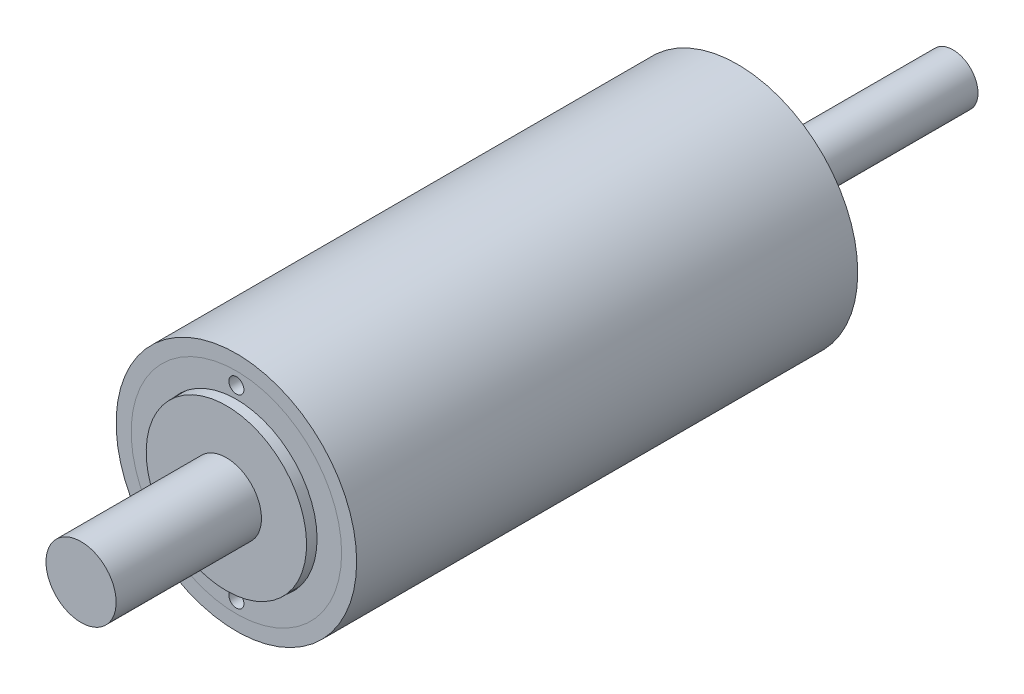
SolidWorks part; units mm, degrees
other "Spacer"
other "6201 DgFr"
other "Front Preload Nut"
other "7203 AngRr"
other "7203 AngFr"
other "Inner Spindle"
other "Lockring Rear"
other "Lockring Front"
other "Outer Spindle"
other "Rear Preload"
other "6201 DgRr"
ref_plane "Front Plane" through (0, 0, 0) normal (0, 0, 1) x (1, 0, 0)
ref_plane "Top Plane" through (0, 0, 0) normal (0, 1, 0) x (1, 0, 0)
ref_plane "Right Plane" through (0, 0, 0) normal (1, 0, 0) x (0, 0, -1)
sketch "Sketch1" plane through (0, 0, 0) normal (1, 0, 0) x (0, 0, -1)
  line L0 (-126.3943, 0) -> (126.3943, 0) construction
  line L1 (-50, 19.3253) -> (-50, -19.3253) construction
  line L2 (50, 19.03) -> (50, -19.03) construction
  line L3 (-81, 0) -> (-81, 7)
  line L4 (-81, 7) -> (-52, 7)
  line L5 (-52, 7) -> (-52, 16)
  line L6 (-52, 16) -> (-48, 16)
  line L7 (-48, 16) -> (-48, 7.4)
  line L8 (-48, 7.4) -> (-44, 7.4)
  line L9 (-44, 7.4) -> (-44, 11)
  line L10 (-44, 11) -> (-40, 11)
  line L11 (-40, 11) -> (-40, 8.5)
  line L12 (-40, 8.5) -> (-16, 8.5)
  line L15 (-1, 8.45) -> (-1, 7.4)
  line L17 (-1, 7.4) -> (9, 7.4)
  line L18 (9, 7.4) -> (9, 6)
  line L21 (53, 5.95) -> (53, 5)
  line L22 (53, 5) -> (93, 5)
  line L23 (93, 5) -> (93, 0)
  line L24 (-81, 0) -> (93, 0)
  line L26 (-16, 7.5) -> (-14, 7.5)
  line L27 (-14, 7.5) -> (-14, 8.45)
  line L28 (-14, 8.45) -> (-1, 8.45)
  line L29 (9, 6) -> (39, 6)
  line L30 (39, 6) -> (39, 5)
  line L31 (39, 5) -> (41, 5)
  line L32 (41, 5) -> (41, 5.95)
  line L33 (41, 5.95) -> (53, 5.95)
  line L34 (-16, 8.5) -> (-16, 7.5)
  point P4 (0, 0)
  point P7 (-50, 0)
  point P10 (50, 0)
  point P22 (0, 0)
  point P36 (0, 0)
  point P38 (-16, 8)
  dimension "D1" = 50
  dimension "D2" = 50
  dimension "D3" = 7
  dimension "D4" = 29
  dimension "D5" = 16
  dimension "D6" = 4
  dimension "D7" = 7.4
  dimension "D8" = 2
  dimension "D9" = 6
  dimension "D10" = 11
  dimension "D11" = 4
  dimension "D12" = 8.5
  dimension "D13" = 24
  dimension "D14" = 8.45
  dimension "D15" = 2
  dimension "D16" = 15
  dimension "D17" = 41
  dimension "D18" = 6
  dimension "D19" = 7.5
  dimension "D20" = 30
  dimension "D21" = 7.4
  dimension "D22" = 3
  dimension "D23" = 5
  dimension "D24" = 40
  dimension "D25" = 5.95
  dimension "D26" = 2
  dimension "D27" = 5
revolve "Revolve2" add sketch "Sketch1" angle 360 about L0
sketch "Sketch5" plane through (0, 0, 40) normal (0, 0, -1) x (-1, 0, 0)
  circle A0 centre (0, 0) radius 8.5 construction
  circle A1 centre (0, 0) radius 8.5
  circle A2 centre (0, 0) radius 20
  dimension "D1" = 40
extrude "Boss-Extrude1" add sketch "Sketch5" along normal blind 12 separate body
sketch "Sketch6" plane through (0, 0, 28) normal (0, 0, -1) x (-1, 0, 0)
  circle A0 centre (0, 0) radius 8.5 construction
  circle A1 centre (0, 0) radius 8.5
  circle A2 centre (0, 0) radius 20
  dimension "D1" = 40
extrude "Boss-Extrude2" add sketch "Sketch6" along normal blind 12 separate body
sketch "Sketch7" plane through (0, 0, 16) normal (0, 0, -1) x (-1, 0, 0)
  circle A0 centre (0, 0) radius 8.5 construction
  circle A1 centre (0, 0) radius 8.5
  circle A2 centre (0, 0) radius 11.5
  dimension "D1" = 23
extrude "Boss-Extrude3" add sketch "Sketch7" along normal blind 2 separate body
sketch "Sketch8" plane through (0, 0, 14) normal (0, 0, -1) x (-1, 0, 0)
  circle A0 centre (0, 0) radius 17.5
  circle A1 centre (0, 0) radius 8.5 construction
  circle A2 centre (0, 0) radius 8.5
  dimension "D1" = 35
extrude "Boss-Extrude4" add sketch "Sketch8" along normal blind 8
sketch "Sketch9" plane through (0, 0, -9) normal (0, 0, -1) x (-1, 0, 0)
  circle A0 centre (0, 0) radius 6 construction
  circle A1 centre (0, 0) radius 6
  circle A2 centre (0, 0) radius 16
  dimension "D1" = 32
extrude "Boss-Extrude5" add sketch "Sketch9" along normal blind 10 separate body
sketch "Sketch11" plane through (0, 0, -19) normal (0, 0, -1) x (-1, 0, 0)
  circle A0 centre (0, 0) radius 16 construction
  circle A1 centre (0, 0) radius 16
  circle A2 centre (0, 0) radius 14
  circle A3 centre (0, 0) radius 15.5
  dimension "D1" = 28
  dimension "D2" = 31
extrude "Boss-Extrude8" add sketch "Sketch11" along normal blind 10 separate body contours A3 A2
sketch "Sketch12" plane through (0, 0, -29) normal (0, 0, -1) x (-1, 0, 0)
  circle A0 centre (0, 0) radius 6 construction
  circle A1 centre (0, 0) radius 6
  circle A2 centre (0, 0) radius 16
  dimension "D1" = 32
extrude "Boss-Extrude9" add sketch "Sketch12" along normal blind 10 separate body
sketch "Sketch13" plane through (0, 0, -39) normal (0, 0, -1) x (-1, 0, 0)
  circle A0 centre (0, 0) radius 6 construction
  circle A1 centre (0, 0) radius 6
  circle A2 centre (0, 0) radius 9
  dimension "D1" = 18
extrude "Boss-Extrude10" add sketch "Sketch13" along normal blind 2 separate body
sketch "Sketch14" plane through (0, 0, -41) normal (0, 0, -1) x (-1, 0, 0)
  circle A0 centre (0, 0) radius 13
  circle A1 centre (0, 0) radius 6 construction
  circle A2 centre (0, 0) radius 6
  dimension "D1" = 26
extrude "Boss-Extrude11" add sketch "Sketch14" along normal blind 8
sketch "Sketch15" plane through (0, 0, 0) normal (0, 0, 1) x (1, 0, 0)
  circle A0 centre (0, 0) radius 24
  dimension "D1" = 48
extrude "Boss-Extrude12" add sketch "Sketch15" along normal mid plane 100 separate body
sketch "Sketch16" plane through (0, 0, -50) normal (0, 0, -1) x (-1, 0, 0)
  circle A0 centre (0, 0) radius 16
  dimension "D1" = 32
extrude "Cut-Extrude1" cut sketch "Sketch16" against normal up to next (100 mm away)
sketch "Sketch17" plane through (0, 0, -50) normal (0, 0, -1) x (-1, 0, 0)
  circle A0 centre (0, 0) radius 21
  circle A1 centre (0, 0) radius 16 construction
  circle A2 centre (0, 0) radius 16
  dimension "D1" = 42
extrude "Cut-Extrude2" cut sketch "Sketch17" against normal blind 11
sketch "Sketch18" plane through (0, 0, 50) normal (0, 0, 1) x (1, 0, 0)
  circle A0 centre (0, 0) radius 20
  circle A1 centre (0, 0) radius 16 construction
  circle A2 centre (0, 0) radius 16
  dimension "D1" = 40
extrude "Cut-Extrude3" cut sketch "Sketch18" against normal blind 34
sketch "Sketch19" plane through (0, 0, 16) normal (0, 0, 1) x (1, 0, 0)
  circle A0 centre (0, 0) radius 18
  circle A1 centre (0, 0) radius 16 construction
  circle A2 centre (0, 0) radius 16
  dimension "D1" = 36
extrude "Cut-Extrude4" cut sketch "Sketch19" against normal blind 14
sketch "Sketch20" plane through (0, 0, 50) normal (0, 0, 1) x (1, 0, 0)
  circle A0 centre (0, 0) radius 21
  circle A1 centre (0, 0) radius 20 construction
  circle A2 centre (0, 0) radius 20
  dimension "D1" = 42
extrude "Cut-Extrude5" cut sketch "Sketch20" against normal blind 10
sketch "Sketch21" plane through (0, 0, 50) normal (0, 0, 1) x (1, 0, 0)
  circle A0 centre (0, 0) radius 16.1
  circle A1 centre (0, 0) radius 21 construction
  circle A2 centre (0, 0) radius 21
  dimension "D1" = 32.2
extrude "Boss-Extrude13" add sketch "Sketch21" against normal blind 10 separate body
sketch "Sketch22" plane through (0, 0, 50) normal (0, 0, 1) x (1, 0, 0)
  line L0 (0, -18.5) -> (0, 18.5) construction
  circle A0 centre (0, 0) radius 18.5 construction
  circle A1 centre (0, -18.5) radius 1.5
  circle A2 centre (0, 18.5) radius 1.5
  dimension "D1" = 37
  dimension "D2" = 3
extrude "Cut-Extrude6" cut sketch "Sketch22" against normal blind 5
sketch "Sketch23" plane through (0, 0, -50) normal (0, 0, -1) x (-1, 0, 0)
  circle A0 centre (0, 0) radius 13.5
  circle A1 centre (0, 0) radius 21 construction
  circle A2 centre (0, 0) radius 21
  dimension "D1" = 27
extrude "Boss-Extrude14" add sketch "Sketch23" against normal blind 10 separate body
sketch "Sketch24" plane through (0, 0, -50) normal (0, 0, -1) x (-1, 0, 0)
  line L0 (0, -18.5) -> (0, 18.5) construction
  circle A0 centre (0, 0) radius 18.5 construction
  circle A1 centre (0, -18.5) radius 1.5
  circle A2 centre (0, 18.5) radius 1.5
  dimension "D1" = 37
  dimension "D2" = 3
extrude "Cut-Extrude7" cut sketch "Sketch24" against normal blind 5 contours A1 | A2
